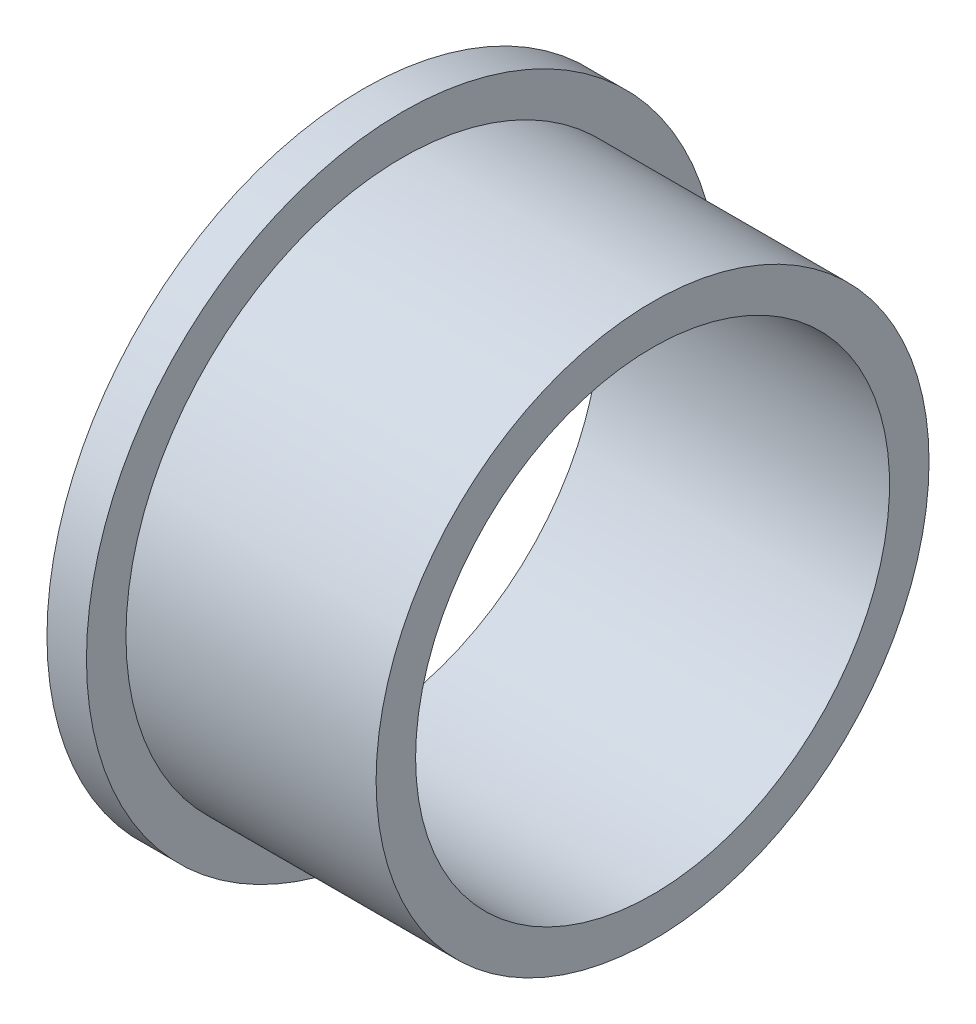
SolidWorks part; units mm, degrees
ref_plane "Front" through (0, 0, 0) normal (0, 0, 1) x (1, 0, 0)
ref_plane "Top" through (0, 0, 0) normal (0, 1, 0) x (1, 0, 0)
ref_plane "Right" through (0, 0, 0) normal (1, 0, 0) x (0, 0, -1)
sketch "Schizzo1" plane through (0, 0, 0) normal (0, 0, 1) x (1, 0, 0)
  line L0 (-11, 0) -> (11, 0) construction
  line L1 (-11, 24) -> (-8, 24)
  line L2 (-8, 24) -> (-8, 21)
  line L3 (-8, 21) -> (11, 21)
  line L4 (11, 21) -> (11, 18)
  line L5 (11, 18) -> (-11, 18)
  line L6 (-11, 18) -> (-11, 24)
  point P3 (0, 0)
  point P10 (0, 0)
  point P11 (0, 0)
  dimension "D1" = 3
  dimension "D2" = 22
  dimension "D3" = 36
  dimension "D4" = 42
  dimension "D5" = 48
revolve "Rivoluzione1" add sketch "Schizzo1" angle 360 about L0
